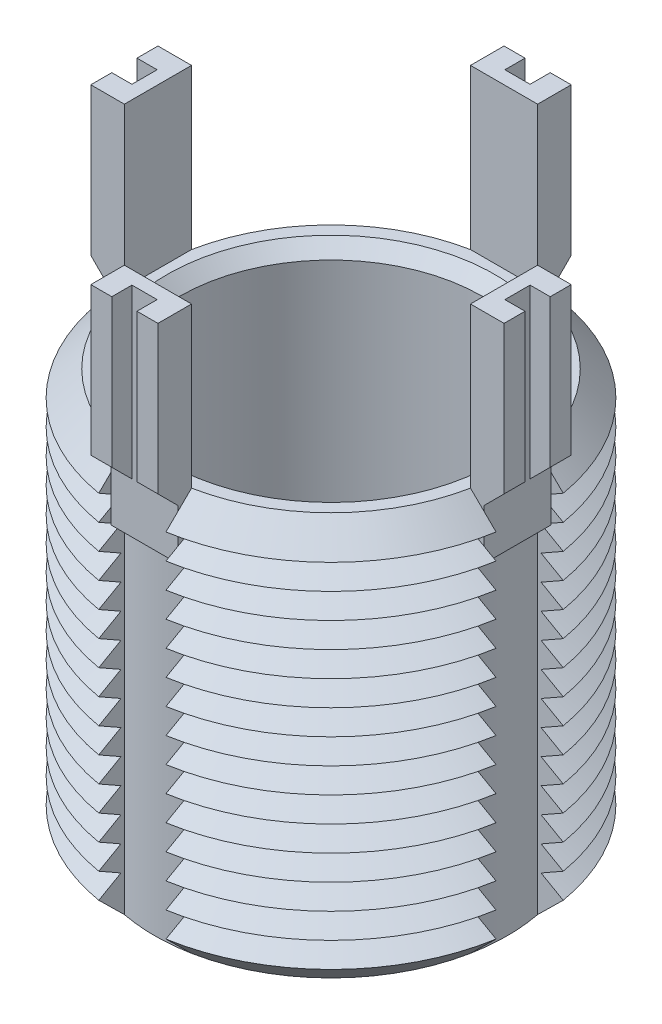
SolidWorks part; units mm, degrees
ref_plane "Front Plane" through (0, 0, 0) normal (0, 0, 1) x (1, 0, 0)
ref_plane "Top Plane" through (0, 0, 0) normal (0, 1, 0) x (1, 0, 0)
ref_plane "Right Plane" through (0, 0, 0) normal (1, 0, 0) x (0, 0, -1)
sketch "Sketch1" plane through (0, 0, 0) normal (0, 1, 0) x (1, 0, 0)
  circle A0 centre (0, 0) radius 12
  dimension "D1" = 24
extrude "Boss-Extrude1" add sketch "Sketch1" against normal blind 24
chamfer "Chamfer1" distance 1.5 angle 45 2 edges at (0, -24, 12) (0, 0, 12)
sketch "Sketch2" plane through (0, 0, 0) normal (1, 0, 0) x (0, 0, -1)
  line L0 (0, 0.8859) -> (0, -9.2617) construction
sketch "Sketch3" plane through (0, 0, 0) normal (1, 0, 0) x (0, 0, -1)
  line L0 (-12, -1.5) -> (-10.701, -2.25)
  line L1 (-10.701, -2.25) -> (-12, -3)
  line L2 (-12, -1.5) -> (-12, -22.5) construction
  line L3 (-12, -3) -> (-12, -1.5)
  dimension "D1" = 1.5
revolve "Cut-Revolve1" cut sketch "Sketch3" angle 360 about L0
pattern_linear "LPattern1" count 14 spacing 1.5 along (0, -1, 0) of "Cut-Revolve1"
sketch "Sketch4" plane through (0, 0, 0) normal (0, 1, 0) x (1, 0, 0)
  line L0 (-10.3078, 2) -> (-11.8322, 2)
  line L2 (-11.8322, -2) -> (-10.3078, -2)
  arc A0 (-10.3078, 2) -> (-10.3078, -2) centre (0, 0) ccw
  arc A1 (-11.8322, 2) -> (-11.8322, -2) centre (0, 0) ccw
  circle A2 centre (0, 0) radius 12 construction
  circle A3 centre (0, 0) radius 10.5 construction
  point P1 (-10.5, 0)
  point P3 (-12, 0)
  point P13 (0, 0)
  dimension "D1" = 4
extrude "Cut-Extrude1" cut sketch "Sketch4" against normal up to surface (24 mm away)
pattern_circular "CirPattern1" count 4 over 360 about axis through (0, 0, 0) along (0, 1, 0) of "Cut-Extrude1"
sketch "Sketch5" plane through (0, 0, 0) normal (1, 0, 0) x (0, 0, -1)
  line L0 (-10.3078, 9.5) -> (-10.3078, -3.5)
  line L1 (-10.3078, -3.5) -> (-11.1078, -3.5)
  line L2 (-11.1078, -3.5) -> (-11.1078, -0.5)
  line L3 (-11.1078, -0.5) -> (-12.3078, 0.7)
  line L4 (-12.3078, 0.7) -> (-12.3078, 9.5)
  line L5 (-12.3078, 9.5) -> (-10.3078, 9.5)
  line L6 (-11.8322, -4.5) -> (-2, -4.5) construction
  point P9 (-2, 0)
  point P10 (-11.1078, -0.5)
  dimension "D1" = 1
  dimension "D2" = 13
  dimension "D3" = 10
  dimension "D4" = 2
  dimension "D5" = 0.8
  dimension "D6" = 45
extrude "Boss-Extrude3" add sketch "Sketch5" along normal mid plane 4
pattern_circular "CirPattern2" count 4 over 360 about axis through (0, 0, 0) along (0, 1, 0) of "Boss-Extrude3"
sketch "Sketch6" plane through (0, 9.5, 0) normal (0, 1, 0) x (1, 0, 0)
  line L0 (-12.3078, -2) -> (-12.3078, 2) construction
  line L1 (-12.3078, -0.75) -> (-11.1078, -0.75)
  line L2 (-12.3078, -0.75) -> (-12.3078, 0.75)
  line L3 (-12.3078, 0.75) -> (-11.1078, 0.75)
  line L4 (-11.1078, -0.75) -> (-11.1078, 0.75)
  line L5 (-12.3078, -0.75) -> (-11.1078, 0.75) construction
  line L6 (-12.3078, 0.75) -> (-11.1078, -0.75) construction
  line L7 (12.3078, 2) -> (12.3078, -2) construction
  line L8 (-0.75, 11.1078) -> (0.75, 11.1078)
  line L9 (-0.75, 11.1078) -> (-0.75, 12.3078)
  line L10 (-0.75, 12.3078) -> (0.75, 12.3078)
  line L11 (0.75, 11.1078) -> (0.75, 12.3078)
  line L12 (-0.75, 11.1078) -> (0.75, 12.3078) construction
  line L13 (-0.75, 12.3078) -> (0.75, 11.1078) construction
  line L14 (11.1078, -0.75) -> (12.3078, -0.75)
  line L15 (11.1078, -0.75) -> (11.1078, 0.75)
  line L16 (11.1078, 0.75) -> (12.3078, 0.75)
  line L17 (12.3078, -0.75) -> (12.3078, 0.75)
  line L18 (11.1078, -0.75) -> (12.3078, 0.75) construction
  line L19 (11.1078, 0.75) -> (12.3078, -0.75) construction
  line L20 (-0.75, -12.3078) -> (0.75, -12.3078)
  line L21 (-0.75, -12.3078) -> (-0.75, -11.1078)
  line L22 (-0.75, -11.1078) -> (0.75, -11.1078)
  line L23 (0.75, -12.3078) -> (0.75, -11.1078)
  line L24 (-0.75, -12.3078) -> (0.75, -11.1078) construction
  line L25 (-0.75, -11.1078) -> (0.75, -12.3078) construction
  line L26 (-2, 12.3078) -> (2, 12.3078) construction
  line L27 (2, -12.3078) -> (-2, -12.3078) construction
  point P0 (-11.7078, 0)
  point P7 (-12.3078, 0)
  point P8 (-12.3078, 0)
  point P9 (0, 11.7078)
  point P14 (11.7078, 0)
  point P19 (0, -11.7078)
  point P24 (0, 12.3078)
  point P25 (12.3078, 0)
  point P26 (12.3078, 0)
  point P27 (0, 12.3078)
  point P30 (0, -12.3078)
  point P33 (0, -12.3078)
  dimension "D1" = 1.5
  dimension "D2" = 1.2
extrude "Cut-Extrude3" cut sketch "Sketch6" against normal through all both and the other way through all
sketch "Sketch7" plane through (0, 0, 0) normal (0, 1, 0) x (1, 0, 0)
  circle A0 centre (0, 0) radius 9
  dimension "D1" = 18
extrude "Cut-Extrude4" cut sketch "Sketch7" against normal up to surface (24 mm away)
chamfer "Chamfer2" distance 0.75 angle 45 2 edges at (0, 0, 9) (0, -24, 9)
